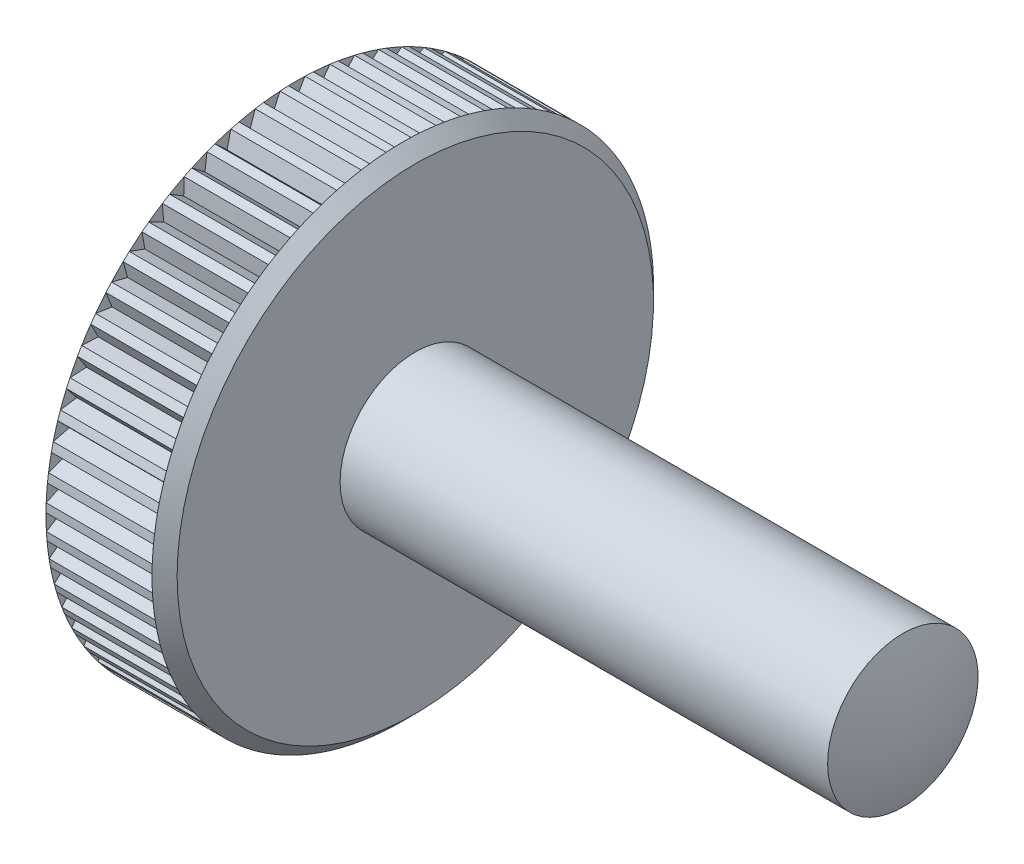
SolidWorks part; units mm, degrees
ref_plane "Front" through (0, 0, 0) normal (0, 0, 1) x (1, 0, 0)
ref_plane "Top" through (0, 0, 0) normal (0, 1, 0) x (1, 0, 0)
ref_plane "Right" through (0, 0, 0) normal (1, 0, 0) x (0, 0, -1)
sketch "Sketch1" plane through (0, 0, 0) normal (0, 0, 1) x (1, 0, 0)
  line L0 (0, 0) -> (26, 0)
  line L1 (1.2702, 10) -> (6, 10)
  line L2 (6, 10) -> (6, 3)
  line L7 (6, 3) -> (25.446, 3)
  line L9 (-48.2111, 0) -> (101.1311, 0) construction
  arc A0 (26, 0) -> (25.446, 3) centre (17.6, 0) ccw
  arc A1 (1.2702, 10) -> (0, 0) centre (40, 0) ccw
  dimension "re" = 8.4
  dimension "dr" = 40
  dimension "dk" = 20
  dimension "d" = 6
  dimension "k" = 6
  dimension "l" = 20
revolve "Base" add sketch "Sketch1" angle 360 about L9
chamfer "Chamfer1" distance 0.5 angle 45 1 edges at (6, 0, 10)
ref_plane "Plane2" through (1.27, 0, 0) normal (1, 0, 0) x (0, 0, -1)
ref_plane "Plane3" through (5.5, 0, 0) normal (1, 0, 0) x (0, 0, -1)
sketch "Sketch2" plane through (1.27, 0, 0) normal (1, 0, 0) x (0, 0, -1)
  line L1 (0, 9.4226) -> (0.5, 10.2887)
  line L2 (0.5, 10.2887) -> (-0.5, 10.2887)
  line L3 (-0.5, 10.2887) -> (0, 9.4226)
  circle A0 centre (0, 0) radius 10 construction
  circle A2 centre (0, 10) radius 0.2887 construction
  dimension "D1" = 1
extrude "Cut-Extrude1" cut sketch "Sketch2" along normal up to surface (4.23 mm away)
pattern_circular "Circular-Pattern1" count 63 over 360 about axis through (0, 0, 0) along (1, 0, 0) of "Cut-Extrude1"
sketch "Sketch3" plane through (0, 0, 0) normal (0, 0, 1) x (1, 0, 0)
  line L0 (6, 3.75) -> (6.75, 3.75)
  line L1 (6.75, 3.75) -> (6.75, 3)
  line L2 (6.75, 3) -> (6.375, 2.3505)
  line L3 (6.375, 2.3505) -> (6, 3)
  line L4 (6, 3) -> (6, 3.75)
  line L5 (6, -3) -> (6, 3) construction
  line L6 (25.446, 3) -> (6, 3) construction
  dimension "D1" = 0.75
revolve "Cut-Revolve10" [suppressed] cut sketch "Sketch3" angle 360 about axis through (-48.2111, 0, 0) along (1, 0, 0)
pattern_linear "LPattern10" [suppressed] count 22 along (1, 0, 0)
equation "\"D1@Circular-Pattern1\" =int (  \"dk@Sketch1\" * PI+1 ) "
equation "\"D1@Plane3\" = \"c@Chamfer1\""
equation "\"D1@Sketch3\" =  ( \"d@Sketch1\" - \"THD_MINOR@ThreadCosmetic1\" )  / 2"
equation "\"pitch@LPattern10\" = 1.2 * \"D1@Sketch3\""
equation "\"D1@LPattern10\" = \"l@Sketch1\" / \"pitch@LPattern10\""
